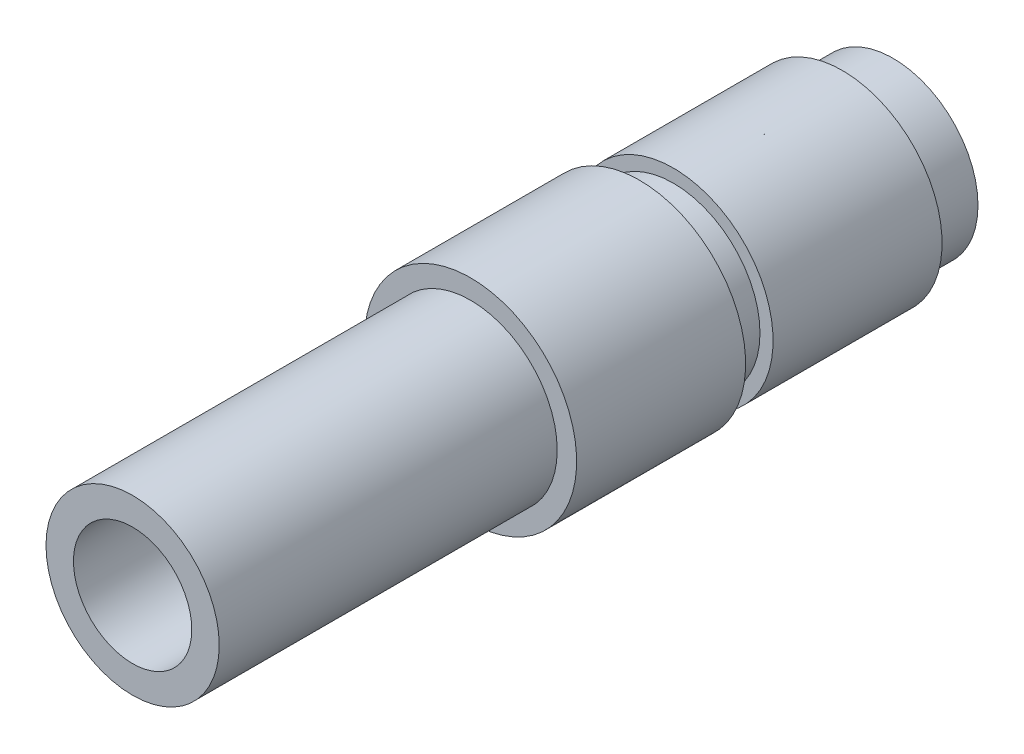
SolidWorks part; units mm, degrees
ref_plane "Front Plane" through (0, 0, 0) normal (0, 0, 1) x (1, 0, 0)
ref_plane "Top Plane" through (0, 0, 0) normal (0, 1, 0) x (1, 0, 0)
ref_plane "Right Plane" through (0, 0, 0) normal (1, 0, 0) x (0, 0, -1)
sketch "Sketch1" plane through (0, 0, 0) normal (0, 0, 1) x (1, 0, 0)
  circle A0 centre (0, 0) radius 2.6035
  dimension "D1" = 5.207
extrude "Extrude2" add sketch "Sketch1" against normal blind 10.16
sketch "Sketch2" plane through (0, 0, -10.16) normal (0, 0, -1) x (-1, 0, 0)
  circle A0 centre (0, 0) radius 3.1877
  dimension "D1" = 6.3754
extrude "Extrude3" add sketch "Sketch2" along normal blind 5.08
sketch "Sketch3" plane through (0, 0, -15.24) normal (0, 0, -1) x (-1, 0, 0)
  circle A0 centre (0, 0) radius 2.6035
  dimension "D1" = 5.207
extrude "Extrude4" add sketch "Sketch3" along normal blind 1.016
sketch "Sketch4" plane through (0, 0, -16.256) normal (0, 0, -1) x (-1, 0, 0)
  circle A0 centre (0, 0) radius 2.9972
  dimension "D1" = 5.9944
extrude "Extrude5" add sketch "Sketch4" along normal blind 5.08
sketch "Sketch5" plane through (0, 0, -21.336) normal (0, 0, -1) x (-1, 0, 0)
  circle A0 centre (0, 0) radius 2.5527
  dimension "D1" = 5.1054
extrude "Extrude6" add sketch "Sketch5" along normal blind 1.524
sketch "Sketch6" plane through (0, 0, 0) normal (0, 0, 1) x (1, 0, 0)
  circle A0 centre (0, 0) radius 1.778
  dimension "D1" = 3.556
extrude "Cut-Extrude1" cut sketch "Sketch6" against normal through all
sketch "Sketch7" plane through (0, 0, -22.86) normal (0, 0, -1) x (-1, 0, 0)
  circle A0 centre (0, 0) radius 2.1209
  dimension "D1" = 4.2418
extrude "CNTR Bore" cut sketch "Sketch7" against normal blind 0.5588
sketch "Sketch9" plane through (0, 0, 0) normal (1, 0, 0) x (0, 0, -1)
  line L0 (22.3012, 2.1209) -> (18.6277, 0)
  line L1 (22.86, 2.1209) -> (22.3012, 2.1209) construction
  line L2 (22.3012, 0) -> (18.6277, 0)
  line L3 (22.3012, -2.1209) -> (22.3012, 2.1209) construction
  line L4 (22.3012, 1.778) -> (0, 1.778) construction
  line L6 (22.3012, 2.1209) -> (22.3012, 0)
  dimension "D1" = 30
revolve "120deg Bevel" cut sketch "Sketch9" angle 360 about axis through (0, 0, -22.86) along (0, 0, 1)
sketch "Lens Seat" plane through (0, 0, 0) normal (1, 0, 0) x (0, 0, -1)
  line L0 (0, 0) -> (3.8211, 0) construction
  line L1 (22.86, -2.5527) -> (22.86, 2.5527) construction
  line L2 (23.0124, 0) -> (20.8124, 0)
  line L3 (23.0124, 0) -> (22.86, 2.1209)
  line L4 (22.86, 2.1209) -> (22.3012, 2.1209) construction
  line L5 (22.86, 2.1209) -> (22.4278, 2.1209)
  arc A0 (22.4278, 2.1209) -> (20.8124, 0) centre (23.0124, 0) ccw
  dimension "D1" = 4.4
  dimension "D2" = 0.1524
revolve "Cut-Revolve3" cut sketch "Lens Seat" angle 360 about L0
